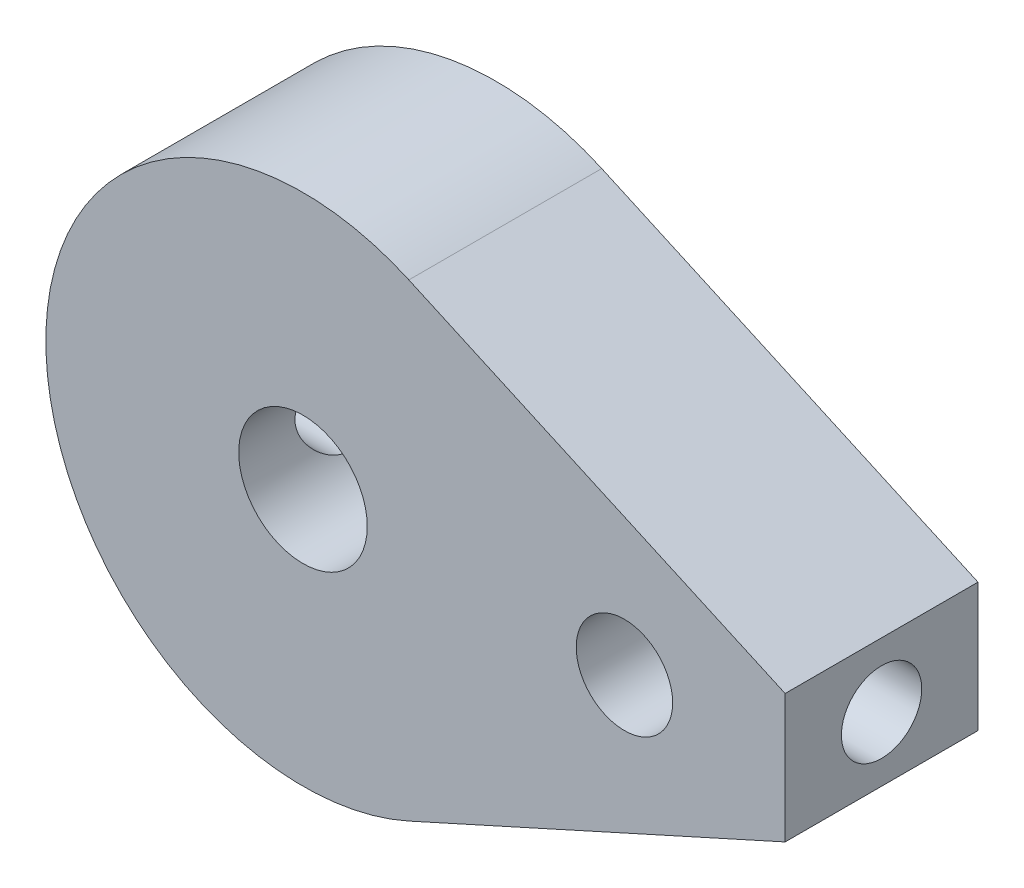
SolidWorks part; units mm, degrees
ref_plane "Front" through (0, 0, 0) normal (0, 0, 1) x (1, 0, 0)
ref_plane "Top" through (0, 0, 0) normal (0, 1, 0) x (1, 0, 0)
ref_plane "Right" through (0, 0, 0) normal (1, 0, 0) x (0, 0, -1)
sketch "Esquisse1" plane through (0, 0, 0) normal (0, 0, 1) x (1, 0, 0)
  line L0 (50, 0) -> (-50, 0) construction
  line L1 (0, -2) -> (0, 2)
  line L2 (0, -50) -> (0, 50) construction
  line L3 (0, 2) -> (-11.7053, 7.2901)
  line L4 (-28.3302, 0) -> (5.003, 0) construction
  line L5 (0, -2) -> (-11.7053, -7.2901)
  arc A0 (-11.7053, 7.2901) -> (-11.7053, -7.2901) centre (-15, 0) ccw
  circle A1 centre (-5, 0) radius 1.5
  circle A2 centre (-15, 0) radius 2
  point P15 (0, 0)
  dimension "D1" = 16
  dimension "D4" = 3
  dimension "D6" = 4
  dimension "D2" = 15
  dimension "D3" = 2
  dimension "D5" = 5
extrude "Boss.-Extru.1" add sketch "Esquisse1" along normal blind 6
hole_wizard "Trou taraudé M31" positions "Esquisse3" profile "Esquisse2" tap size "M3" standard "ISO"
sketch "Esquisse3" plane through (0, 0, 0) normal (1, 0, 0) x (0, 0, -1)
  line L0 (0, -2) -> (0, 2) construction
  point P0 (-3, 0)
  dimension "D1" = 3
sketch "Esquisse2" plane through (0, 0, 3) normal (0, 1, 0) x (0, 0, -1)
  line L0 (0, 0) -> (0, 3.5)
  line L1 (0, 3.5) -> (1.25, 3.5)
  line L2 (1.25, 3.5) -> (1.25, 0)
  line L5 (1.25, 0) -> (0, 0)
  line L11 (0, -6.35) -> (0, 107.95) construction
  dimension "Diamètre du trou pour taraudage jusqu'au prochain" = 2.5
  dimension "Profondeur du trou pour taraudage jusqu'au prochain" = 3.5
ref_plane "Plan1" through (-23, 0, 0) normal (1, 0, 0) x (0, 0, -1)
hole_wizard "Trou taraudé M32" positions "Esquisse5" profile "Esquisse4" tap size "M3" standard "ISO"
sketch "Esquisse5" plane through (-23, 0, 0) normal (1, 0, 0) x (0, 0, -1)
  line L0 (0, -8) -> (0, 8) construction
  point P0 (-3, 0)
  point P3 (0, 0)
  dimension "D1" = 3
sketch "Esquisse4" plane through (-23, 0, 3) normal (0, 1, 0) x (0, 0, 1)
  line L0 (0, 0) -> (0, 6)
  line L1 (0, 6) -> (1.25, 6)
  line L2 (1.25, 6) -> (1.25, 0)
  line L5 (1.25, 0) -> (0, 0)
  line L11 (0, -6.35) -> (0, 107.95) construction
  dimension "Diamètre du trou pour taraudage jusqu'au prochain" = 2.5
  dimension "Profondeur du trou pour taraudage jusqu'au prochain" = 6
